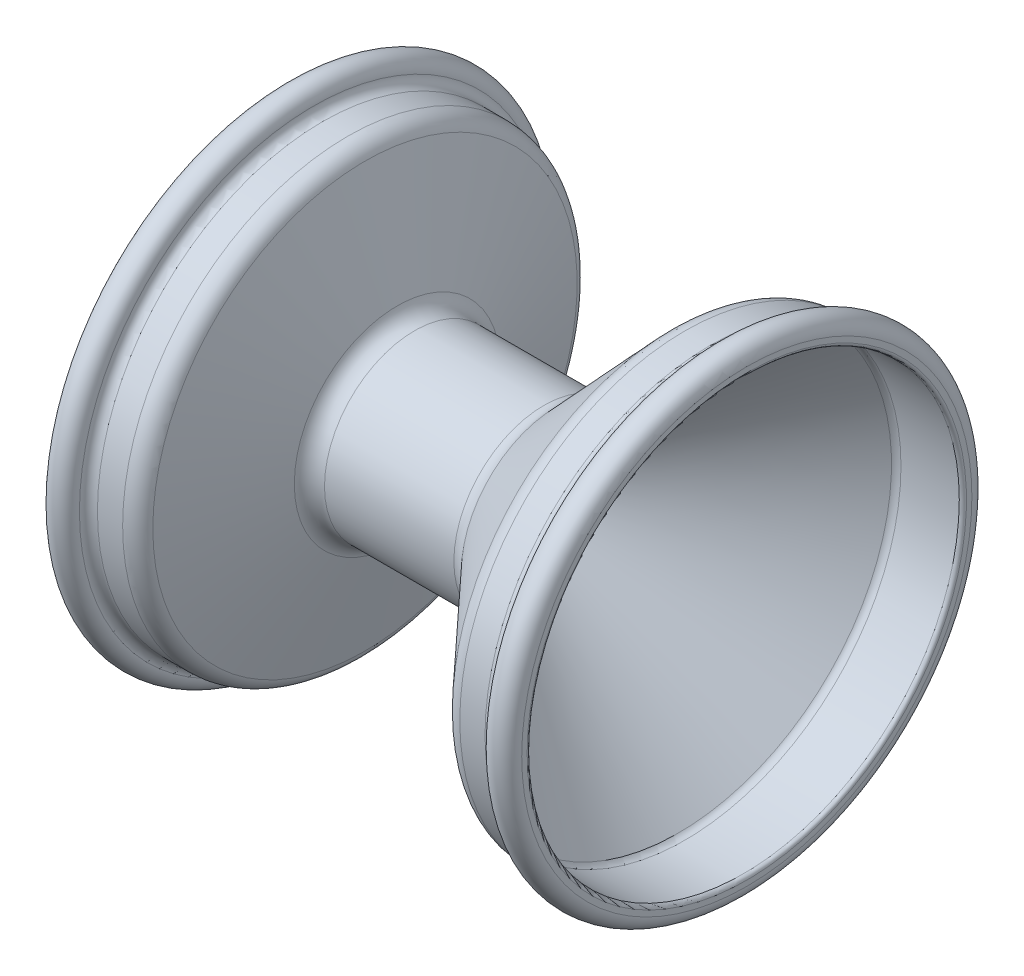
SolidWorks part; units mm, degrees
ref_plane "Plan1" through (0, 0, 0) normal (0, 0, 1) x (1, 0, 0)
ref_plane "Plan2" through (0, 0, 0) normal (0, 1, 0) x (1, 0, 0)
ref_plane "Plan3" through (0, 0, 0) normal (1, 0, 0) x (0, 0, -1)
sketch "Esquisse1" plane through (0, 0, 0) normal (0, 0, 1) x (1, 0, 0)
  line L0 (-112, 0) -> (127, 0) construction
  line L1 (-91.7443, 65) -> (-91.7443, 61)
  line L2 (-81.5552, 62.5) -> (-74.5552, 62.5)
  line L3 (-69.7599, 58.9161) -> (-60.8026, 28.5839)
  line L4 (-56.0074, 25) -> (-20.0902, 25)
  line L5 (26.0666, 62.5) -> (19.0666, 62.5)
  line L6 (15.4013, 60.9008) -> (-16.4249, 26.5992)
  line L7 (-84.7443, 25) -> (-84.7443, 20)
  line L8 (-90.7443, 60) -> (-74.5552, 60)
  line L9 (-72.1576, 58.208) -> (-64.2457, 31.4161)
  line L10 (-69.041, 25) -> (-84.7443, 25)
  line L11 (-72.7443, 20) -> (-72.7443, 18)
  line L12 (-84.7443, 20) -> (-72.7443, 20)
  line L13 (-33.4571, 17.5) -> (-33.4571, 18)
  line L14 (-72.7443, 18) -> (-33.4571, 18)
  line L15 (17.234, 59.2004) -> (-21.4571, 17.5)
  line L16 (-33.4571, 17.5) -> (-21.4571, 17.5)
  line L17 (36.2557, 62.5) -> (36.2557, 61)
  line L18 (35.2557, 60) -> (19.0666, 60)
  arc A0 (-16.4249, 26.5992) -> (-20.0902, 25) centre (-20.0902, 30) cw
  arc A1 (-56.0074, 25) -> (-60.8026, 28.5839) centre (-56.0074, 30) cw
  arc A2 (-69.7599, 58.9161) -> (-74.5552, 62.5) centre (-74.5552, 57.5) ccw
  arc A3 (19.0666, 62.5) -> (15.4013, 60.9008) centre (19.0666, 57.5) ccw
  arc A4 (-69.041, 25) -> (-64.2457, 31.4161) centre (-69.041, 30) ccw
  arc A5 (-72.1576, 58.208) -> (-74.5552, 60) centre (-74.5552, 57.5) ccw
  arc A6 (19.0666, 60) -> (17.234, 59.2004) centre (19.0666, 57.5) ccw
  arc A7 (-91.7443, 65) -> (-84.0552, 65) centre (-87.8997, 65) cw
  arc A8 (36.2557, 62.5) -> (28.3798, 64.0517) centre (32.1649, 62.5) ccw
  arc A9 (28.3798, 64.0517) -> (26.0666, 62.5) centre (26.0666, 65) cw
  arc A10 (-84.0552, 65) -> (-81.5552, 62.5) centre (-81.5552, 65) ccw
  arc A11 (35.2557, 60) -> (36.2557, 61) centre (35.2557, 61) ccw
  arc A12 (-91.7443, 61) -> (-90.7443, 60) centre (-90.7443, 61) ccw
  point P25 (-59.7443, 25)
  dimension "D13" = 5
  dimension "D15" = 5
  dimension "D16" = 2.5
  dimension "D12" = 2.5
  dimension "D14" = 2.5
  dimension "D17" = 2.5
  dimension "D18" = 1
  dimension "D19" = 1
  dimension "D1" = 128
  dimension "D2" = 2.5
  dimension "D3" = 7
  dimension "D4" = 20
  dimension "D5" = 18
  dimension "D6" = 2.5
  dimension "D7" = 12
  dimension "D8" = 25
  dimension "D9" = 32
  dimension "D10" = 60
  dimension "D11" = 62.5
  dimension "D20" = 7
  dimension "D21" = 7
  dimension "D22" = 17.5
revolve "Base-Révolution" add sketch "Esquisse1" angle 360 about L0
ref_plane "Plan4" through (-0.5118, 43.75, 0) normal (-0.7331, 0.6802, 0) x (0, 0, -1)
sketch "Esquisse2" plane through (-0.5118, 43.75, 0) normal (-0.7331, 0.6802, 0) x (0, 0, -1)
  line L0 (0, 107.9014) -> (0, -54.6571) construction
  line L1 (0, 81.7234) -> (0, -18.2766) construction
  circle A0 centre (0, -8.752) radius 5
  ellipse E0 centre (0, 21.248) end of major axis (60.9008, 21.248) minor radius 44.6441 construction
  dimension "D1" = 10
  dimension "D2" = 30
extrude "Enlèv. mat.-Extru.1" cut sketch "Esquisse2" against normal through all
